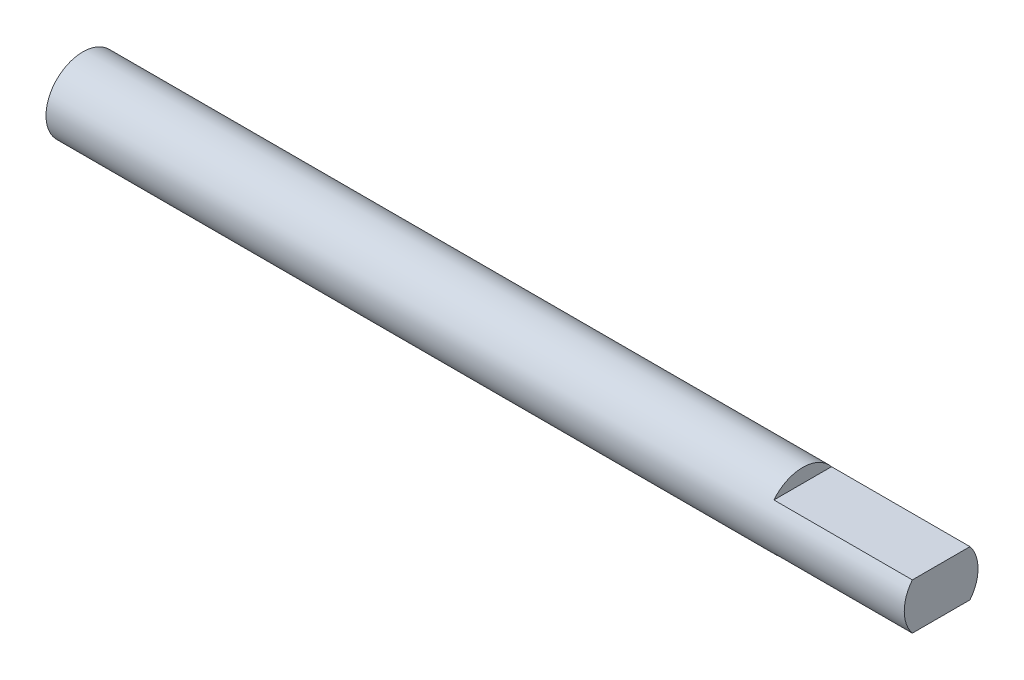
SolidWorks part; units mm, degrees
ref_plane "Plan1" through (0, 0, 0) normal (0, 0, 1) x (1, 0, 0)
ref_plane "Plan2" through (0, 0, 0) normal (0, 1, 0) x (1, 0, 0)
ref_plane "Plan3" through (0, 0, 0) normal (1, 0, 0) x (0, 0, -1)
sketch "Esquisse1" plane through (0, 0, 0) normal (0, 0, 1) x (1, 0, 0)
  line L0 (0, 0) -> (110, 0) construction
  line L1 (0, 0) -> (93, 0)
  line L3 (0, 0) -> (0, 4)
  line L4 (0, 4) -> (93, 4)
  line L5 (93, 0) -> (93, 4)
  dimension "D1" = 8
  dimension "D2" = 93
revolve "Base-Révolution" add sketch "Esquisse1" angle 360 about L0
sketch "Esquisse2" plane through (93, 0, 0) normal (1, 0, 0) x (0, 0, -1)
  line L0 (0, 0) -> (4.5206, 0) construction
  line L1 (-4.3882, 2.5) -> (4.322, 2.5)
  line L2 (-4.3882, 2.5) -> (0.3508, 4.686)
  line L3 (0.3508, 4.686) -> (4.322, 2.5)
  dimension "D1" = 2.5
extrude "Enlèv. mat.-Extru.1" cut sketch "Esquisse2" against normal blind 15
pattern_circular "Répétition circulaire1" count 2 over 360 about axis through (0, 0, 0) along (1, 0, 0)
